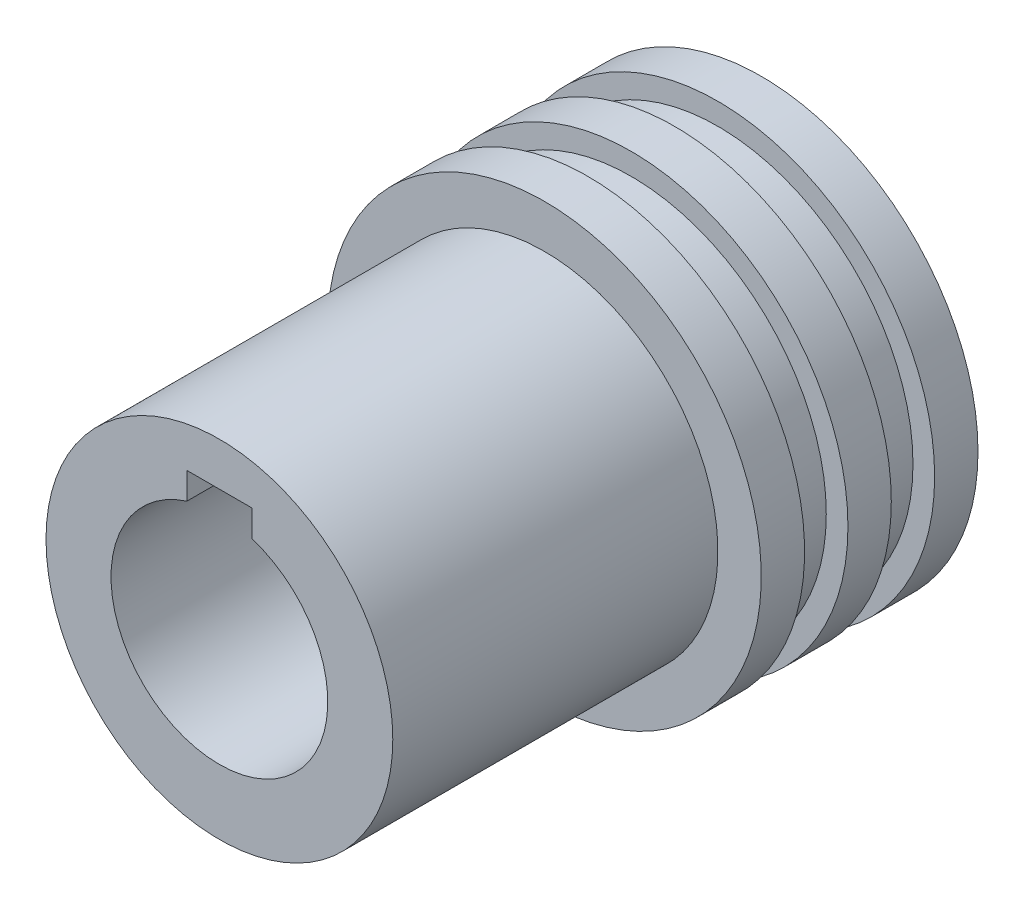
SolidWorks part; units mm, degrees
ref_plane "Plan de face" through (0, 0, 0) normal (0, 0, 1) x (1, 0, 0)
ref_plane "Plan de dessus" through (0, 0, 0) normal (0, 1, 0) x (1, 0, 0)
ref_plane "Plan de droite" through (0, 0, 0) normal (1, 0, 0) x (0, 0, -1)
sketch "Esquisse1" plane through (0, 0, 0) normal (0, 0, 1) x (1, 0, 0)
  circle A0 centre (0, 0) radius 8
  dimension "D1" = 16
extrude "Boss.-Extru.1" add sketch "Esquisse1" along normal blind 15
sketch "Esquisse2" plane through (0, 0, 0) normal (0, 0, -1) x (-1, 0, 0)
  circle A0 centre (0, 0) radius 10
  dimension "D1" = 20
extrude "Boss.-Extru.2" add sketch "Esquisse2" along normal blind 10
sketch "Esquisse3" plane through (0, 0, 0) normal (1, 0, 0) x (0, 0, -1)
  line L0 (0, 0) -> (14.5595, 0) construction
  line L1 (10, -10) -> (10, 10) construction
  line L2 (2, 10.726) -> (4, 10.726)
  line L3 (2, 10.726) -> (2, 9)
  line L4 (2, 9) -> (4, 9)
  line L5 (4, 10.726) -> (4, 9)
  line L6 (6, 10.726) -> (8, 10.726)
  line L7 (6, 10.726) -> (6, 9)
  line L8 (6, 9) -> (8, 9)
  line L9 (8, 10.726) -> (8, 9)
  line L10 (0, 10) -> (0, -10) construction
  line L11 (10, 10) -> (0, 10) construction
  dimension "D1" = 2
  dimension "D2" = 2
  dimension "D3" = 2
  dimension "D4" = 2
  dimension "D5" = 1
revolve "Enlèvement de matière-Révolution1" cut sketch "Esquisse3" angle 360 about L0
sketch "Esquisse4" plane through (0, 0, 15) normal (0, 0, 1) x (1, 0, 0)
  line L1 (-1.5, 6) -> (1.5, 6)
  line L2 (-1.5, 6) -> (-1.5, 4.7697)
  line L4 (1.5, 6) -> (1.5, 4.7697)
  arc A0 (-1.5, 4.7697) -> (1.5, 4.7697) centre (0, 0) ccw
  dimension "D1" = 10
  dimension "D2" = 3
  dimension "D3" = 1.5
  dimension "D4" = 6
extrude "Enlèv. mat.-Extru.1" cut sketch "Esquisse4" against normal blind 26
